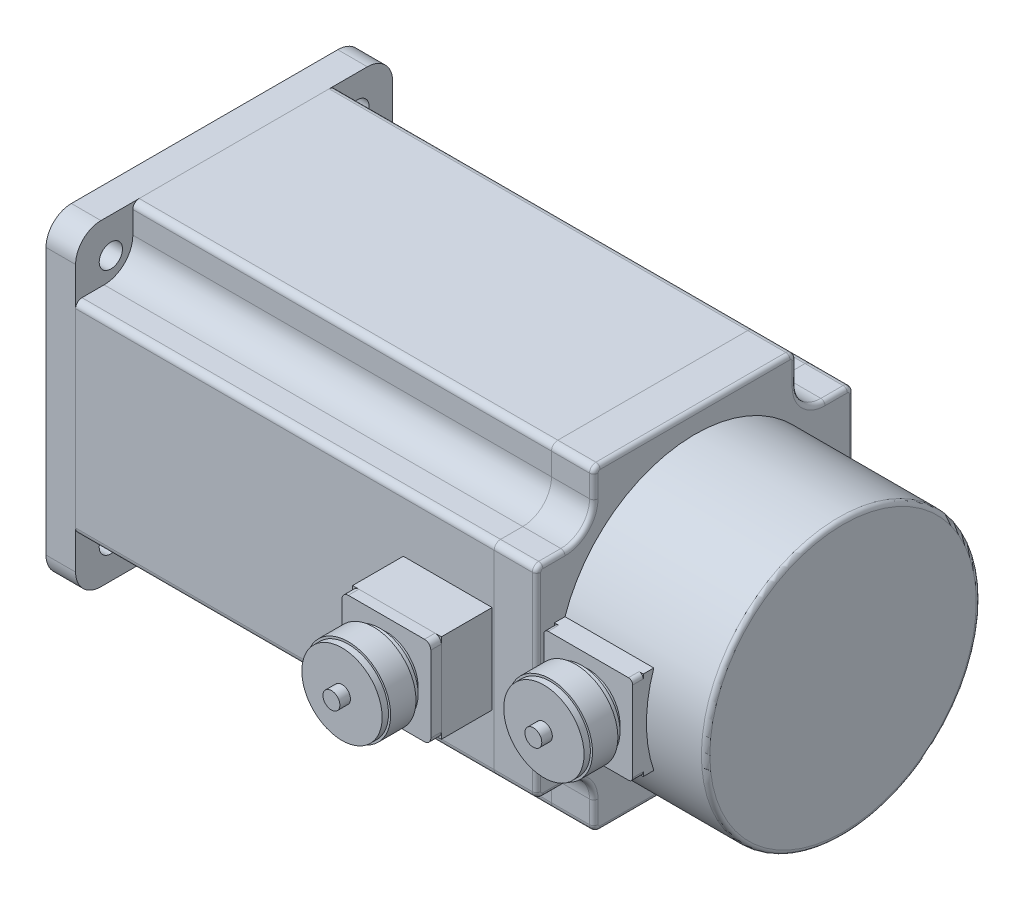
SolidWorks part; units mm, degrees
ref_plane "前视基准面" through (0, 0, 0) normal (0, 0, 1) x (1, 0, 0)
ref_plane "上视基准面" through (0, 0, 0) normal (0, 1, 0) x (1, 0, 0)
ref_plane "右视基准面" through (0, 0, 0) normal (1, 0, 0) x (0, 0, -1)
sketch "草图1" plane through (0, 0, 0) normal (1, 0, 0) x (0, 0, -1)
  line L1 (-63, -75) -> (63, -75)
  line L2 (-75, -63) -> (-75, 63)
  line L3 (-63, 75) -> (63, 75)
  line L4 (75, -63) -> (75, 63)
  line L5 (-75, -75) -> (75, 75) construction
  line L6 (-75, 75) -> (75, -75) construction
  arc A0 (63, -75) -> (75, -63) centre (63, -63) ccw
  arc A1 (-63, -75) -> (-75, -63) centre (-63, -63) cw
  arc A2 (-75, 63) -> (-63, 75) centre (-63, 63) cw
  arc A3 (63, 75) -> (75, 63) centre (63, 63) cw
  point P0 (0, 0)
  dimension "D1" = 12
extrude "凸台-拉伸1" add sketch "草图1" along normal blind 20
sketch "草图2" plane through (0, 0, 0) normal (-1, 0, 0) x (0, 0, 1)
  line L0 (-63, 75) -> (63, 75) construction
  line L1 (-63, -75) -> (63, -75)
  line L2 (-75, -63) -> (-75, 63)
  line L3 (-63, 75) -> (63, 75)
  line L4 (75, -63) -> (75, 63)
  line L5 (-75, -75) -> (75, 75) construction
  line L6 (-75, 75) -> (75, -75) construction
  arc A0 (63, 75) -> (75, 63) centre (63, 63) cw
  arc A1 (63, -75) -> (75, -63) centre (63, -63) ccw
  arc A2 (-63, -75) -> (-75, -63) centre (-63, -63) cw
  arc A3 (-75, 63) -> (-63, 75) centre (-63, 63) cw
  point P0 (0, 0)
  dimension "D1" = 12
extrude "凸台-拉伸2" add sketch "草图2" along normal blind 198 separate body
sketch "草图3" plane through (-198, 0, 0) normal (-1, 0, 0) x (0, 0, 1)
  line L0 (63, 75) -> (-63, 75) construction
  line L1 (-63, -75) -> (63, -75)
  line L2 (-75, -63) -> (-75, 63)
  line L3 (-63, 75) -> (63, 75)
  line L4 (75, -63) -> (75, 63)
  line L5 (-75, -75) -> (75, 75) construction
  line L6 (-75, 75) -> (75, -75) construction
  arc A0 (-63, -75) -> (-75, -63) centre (-63, -63) cw
  arc A1 (63, -75) -> (75, -63) centre (63, -63) ccw
  arc A2 (63, 75) -> (75, 63) centre (63, 63) cw
  arc A3 (-75, 63) -> (-63, 75) centre (-63, 63) cw
  point P0 (0, 0)
  dimension "D1" = 12
extrude "凸台-拉伸3" add sketch "草图3" along normal blind 14 separate body
sketch "草图4" plane through (0, 0, 75) normal (0, 0, 1) x (1, 0, 0)
  line L2 (-43, -21) -> (-1, -21)
  line L3 (-43, -21) -> (-43, 21)
  line L4 (-43, 21) -> (-1, 21)
  line L5 (-1, -21) -> (-1, 21)
  line L6 (-43, -21) -> (-1, 21) construction
  line L7 (-43, 21) -> (-1, -21) construction
extrude "凸台-拉伸4" add sketch "草图4" along normal blind 24 separate body
sketch "草图5" plane through (0, 0, 99) normal (0, 0, 1) x (1, 0, 0)
  line L0 (-1, 21) -> (-43, 21) construction
  line L1 (-40, -21) -> (-4, -21)
  line L2 (-43, -18) -> (-43, 18)
  line L3 (-40, 21) -> (-4, 21)
  line L4 (-1, -18) -> (-1, 18)
  line L5 (-43, -21) -> (-1, 21) construction
  line L6 (-43, 21) -> (-1, -21) construction
  arc A0 (-40, -21) -> (-43, -18) centre (-40, -18) cw
  arc A1 (-4, -21) -> (-1, -18) centre (-4, -18) ccw
  arc A2 (-4, 21) -> (-1, 18) centre (-4, 18) cw
  arc A3 (-43, 18) -> (-40, 21) centre (-40, 18) cw
  point P0 (-22, 0)
  dimension "D1" = 3
extrude "凸台-拉伸5" add sketch "草图5" along normal blind 5 separate body
sketch "草图6" plane through (0, 0, 104) normal (0, 0, 1) x (1, 0, 0)
  circle A0 centre (-22, 0) radius 15
extrude "凸台-拉伸6" add sketch "草图6" along normal blind 3 separate body
sketch "草图7" plane through (0, 0, 107) normal (0, 0, 1) x (1, 0, 0)
  circle A0 centre (-22, 0) radius 18
extrude "凸台-拉伸7" add sketch "草图7" along normal blind 3 separate body
sketch "草图8" plane through (0, 0, 110) normal (0, 0, 1) x (1, 0, 0)
  circle A0 centre (-22, 0) radius 20
extrude "凸台-拉伸8" add sketch "草图8" along normal blind 12 separate body
sketch "草图9" plane through (0, 0, 122) normal (0, 0, 1) x (1, 0, 0)
  circle A0 centre (-22, 0) radius 19
extrude "凸台-拉伸9" add sketch "草图9" along normal blind 3
sketch "草图10" plane through (0, 0, 125) normal (0, 0, 1) x (1, 0, 0)
  circle A0 centre (-22, 0) radius 4
extrude "凸台-拉伸10" add sketch "草图10" along normal blind 5
sketch "草图11" plane through (20, 0, 0) normal (1, 0, 0) x (0, 0, -1)
  line L0 (47.9169, -61.5) -> (47.9169, -72)
  line L1 (-75, -44.9169) -> (-75, -63)
  line L2 (-63, -75) -> (-44.9169, -75)
  line L3 (44.9169, -75) -> (63, -75)
  line L4 (75, -63) -> (75, -44.9169)
  line L6 (75, 63) -> (75, 44.9169)
  line L7 (-63, -75) -> (63, -75) construction
  line L8 (63, 75) -> (44.9169, 75)
  line L9 (-47.9169, -72) -> (-47.9169, -61.5)
  line L10 (-44.9169, 75) -> (-63, 75)
  line L11 (-61.5, -47.9169) -> (-72, -47.9169)
  line L12 (75, -63) -> (75, 63) construction
  line L13 (-75, 63) -> (-75, 44.9169)
  line L14 (-72, 47.9169) -> (-61.5, 47.9169)
  line L16 (-47.9169, 61.5) -> (-47.9169, 72)
  line L17 (63, 75) -> (-63, 75) construction
  line L19 (47.9169, 72) -> (47.9169, 61.5)
  line L21 (61.5, 47.9169) -> (72, 47.9169)
  line L22 (-75, 63) -> (-75, -63) construction
  line L24 (72, -47.9169) -> (61.5, -47.9169)
  arc A0 (-61.5, 47.9169) -> (-47.9169, 61.5) centre (-61.5, 61.5) ccw
  arc A1 (47.9169, 61.5) -> (61.5, 47.9169) centre (61.5, 61.5) ccw
  arc A2 (-47.9169, -61.5) -> (-61.5, -47.9169) centre (-61.5, -61.5) ccw
  arc A3 (-72, -47.9169) -> (-75, -44.9169) centre (-72, -44.9169) cw
  arc A4 (61.5, -47.9169) -> (47.9169, -61.5) centre (61.5, -61.5) ccw
  arc A5 (-75, 44.9169) -> (-72, 47.9169) centre (-72, 44.9169) cw
  arc A6 (-47.9169, 72) -> (-44.9169, 75) centre (-44.9169, 72) cw
  arc A7 (44.9169, 75) -> (47.9169, 72) centre (44.9169, 72) cw
  arc A8 (72, 47.9169) -> (75, 44.9169) centre (72, 44.9169) cw
  arc A9 (75, -44.9169) -> (72, -47.9169) centre (72, -44.9169) cw
  arc A10 (47.9169, -72) -> (44.9169, -75) centre (44.9169, -72) cw
  arc A11 (-44.9169, -75) -> (-47.9169, -72) centre (-44.9169, -72) cw
  arc A12 (-63, 75) -> (-75, 63) centre (-63, 63) ccw
  arc A13 (75, 63) -> (63, 75) centre (63, 63) ccw
  arc A14 (63, -75) -> (75, -63) centre (63, -63) ccw
  arc A15 (-75, -63) -> (-63, -75) centre (-63, -63) ccw
  point P0 (0, 0)
  point P1 (0, 0)
  point P12 (-75, -47.9169)
  point P43 (-75, 47.9169)
  point P47 (-47.9169, 75)
  point P48 (51.9891, -75)
  point P52 (47.9169, 75)
  point P56 (75, 47.9169)
  point P65 (75, -47.9169)
  point P82 (-47.9169, -75)
  dimension "D1" = 3
extrude "切除-拉伸2" cut sketch "草图11" against normal blind 218
fillet "圆角1" radius 2 24 edges at (20, 75, 0) (20, 0, -75) (20, -75, 0) (20, 0, 75) (20, 47.0382, 74.1213) (20, 47.9169, 66.75) (20, 51.8953, 51.8953) (20, 66.75, 47.9169) (20, 74.1213, 47.0382) (20, 74.1213, -47.0382) (20, 66.75, -47.9169) (20, 51.8953, -51.8953) (20, 47.9169, -66.75) (20, 47.0382, -74.1213) (20, -47.0382, -74.1213) (20, -47.9169, -66.75) (20, -51.8953, -51.8953) (20, -66.75, -47.9169) (20, -74.1213, -47.0382) (20, -74.1213, 47.0382) (20, -66.75, 47.9169) (20, -51.8953, 51.8953) (20, -47.9169, 66.75) (20, -47.0382, 74.1213)
sketch "草图12" plane through (-212, 0, 0) normal (-1, 0, 0) x (0, 0, 1)
  circle A2 centre (-58.3363, 58.3363) radius 5.5
  circle A3 centre (58.3363, 58.3363) radius 5.5
  circle A4 centre (58.3363, -58.3363) radius 5.5
  circle A5 centre (-58.3363, -58.3363) radius 5.5
extrude "切除-拉伸3" cut sketch "草图12" against normal blind 14
sketch "草图13" plane through (-212, 0, 0) normal (-1, 0, 0) x (0, 0, 1)
  circle A0 centre (0, 0) radius 65
  circle A1 centre (0, 0) radius 57.5
extrude "凸台-拉伸11" add sketch "草图13" along normal blind 5 separate body
sketch "草图14" plane through (-212, 0, 0) normal (-1, 0, 0) x (0, 0, 1)
  circle A0 centre (0, 0) radius 35
extrude "凸台-拉伸12" add sketch "草图14" along normal blind 5
sketch "草图15" plane through (-217, 0, 0) normal (-1, 0, 0) x (0, 0, 1)
  circle A0 centre (0, 0) radius 17.5
extrude "凸台-拉伸13" add sketch "草图15" along normal blind 0.5 separate body
fillet "圆角2" radius 0.5 1 edges at (-217.5, 0, 17.5)
sketch "草图16" plane through (-217.5, 0, 0) normal (-1, 0, 0) x (0, 0, 1)
  circle A0 centre (0, 0) radius 14
extrude "凸台-拉伸14" add sketch "草图16" along normal blind 52.5
chamfer "倒角1" distance 0.5 angle 45 1 edges at (-270, 0, 14)
ref_plane "基准面1" through (0, -14, 0) normal (0, 1, 0) x (1, 0, 0)
sketch "草图17" plane through (0, -14, 0) normal (0, 1, 0) x (1, 0, 0)
  line L3 (-262, -4) -> (-225, -4)
  line L5 (-225, 4) -> (-262, 4)
  arc A0 (-262, 4) -> (-262, -4) centre (-262, 0) ccw
  arc A1 (-225, -4) -> (-225, 4) centre (-225, 0) ccw
extrude "切除-拉伸4" cut sketch "草图17" along normal blind 5
sketch "草图18" plane through (0, -9, 0) normal (0, -1, 0) x (-1, 0, 0)
  line L0 (262, -4) -> (225, -4)
  line L2 (225, 4) -> (262, 4)
  arc A0 (262, -4) -> (262, 4) centre (262, 0) ccw
  arc A1 (225, 4) -> (225, -4) centre (225, 0) ccw
extrude "凸台-拉伸15" add sketch "草图18" along normal blind 8 separate body
sketch "草图19" plane through (20, 0, 0) normal (1, 0, 0) x (0, 0, -1)
  circle A0 centre (0, 0) radius 65
extrude "凸台-拉伸16" add sketch "草图19" along normal blind 70 separate body
fillet "圆角3" radius 2 1 edges at (90, 0, -65)
ref_plane "基准面2" through (0, 0, 65) normal (0, 0, 1) x (1, 0, 0)
sketch "草图20" plane through (0, 0, 65) normal (0, 0, 1) x (1, 0, 0)
  line L1 (20, 65) -> (20, -65) construction
  line L3 (62, -21) -> (20, -21)
  line L4 (62, -21) -> (62, 21)
  line L5 (62, 21) -> (20, 21)
  line L6 (20, -21) -> (20, 21)
  line L7 (62, -21) -> (20, 21) construction
  line L8 (62, 21) -> (20, -21) construction
extrude "切除-拉伸5" cut sketch "草图20" against normal blind 10
sketch "草图21" plane through (0, 0, 55) normal (0, 0, 1) x (1, 0, 0)
  line L0 (62, 21) -> (20, 21) construction
  line L1 (20, -21) -> (62, -21)
  line L2 (20, -21) -> (20, 21)
  line L3 (20, 21) -> (62, 21)
  line L4 (62, -21) -> (62, 21)
  line L5 (20, -21) -> (62, 21) construction
  line L6 (20, 21) -> (62, -21) construction
  line L7 (20, 21) -> (62, 21) construction
  point P0 (41, 0)
extrude "凸台-拉伸17" add sketch "草图21" along normal blind 11.5
sketch "草图22" plane through (0, 0, 66.5) normal (0, 0, 1) x (1, 0, 0)
  line L0 (62, -21) -> (62, 21) construction
  line L1 (22, -21) -> (60, -21)
  line L2 (20, -19) -> (20, 19)
  line L3 (22, 21) -> (60, 21)
  line L4 (62, -19) -> (62, 19)
  line L5 (20, -21) -> (62, 21) construction
  line L6 (20, 21) -> (62, -21) construction
  line L7 (20, 21) -> (62, 21) construction
  arc A0 (22, -21) -> (20, -19) centre (22, -19) cw
  arc A1 (60, -21) -> (62, -19) centre (60, -19) ccw
  arc A2 (60, 21) -> (62, 19) centre (60, 19) cw
  arc A3 (20, 19) -> (22, 21) centre (22, 19) cw
  point P0 (41, 0)
  dimension "D1" = 2
extrude "凸台-拉伸18" add sketch "草图22" along normal blind 5 separate body
sketch "草图23" plane through (0, 0, 71.5) normal (0, 0, 1) x (1, 0, 0)
  circle A0 centre (41, 0) radius 15
extrude "凸台-拉伸19" add sketch "草图23" along normal blind 3
sketch "草图24" plane through (0, 0, 74.5) normal (0, 0, 1) x (1, 0, 0)
  circle A0 centre (41, 0) radius 18
extrude "凸台-拉伸20" add sketch "草图24" along normal blind 3
sketch "草图25" plane through (0, 0, 77.5) normal (0, 0, 1) x (1, 0, 0)
  circle A0 centre (41, 0) radius 20
extrude "凸台-拉伸21" add sketch "草图25" along normal blind 12
sketch "草图26" plane through (0, 0, 89.5) normal (0, 0, 1) x (1, 0, 0)
  circle A0 centre (41, 0) radius 19
extrude "凸台-拉伸22" add sketch "草图26" along normal blind 3
sketch "草图27" plane through (0, 0, 92.5) normal (0, 0, 1) x (1, 0, 0)
  circle A0 centre (41, 0) radius 4
extrude "凸台-拉伸23" add sketch "草图27" along normal blind 5
